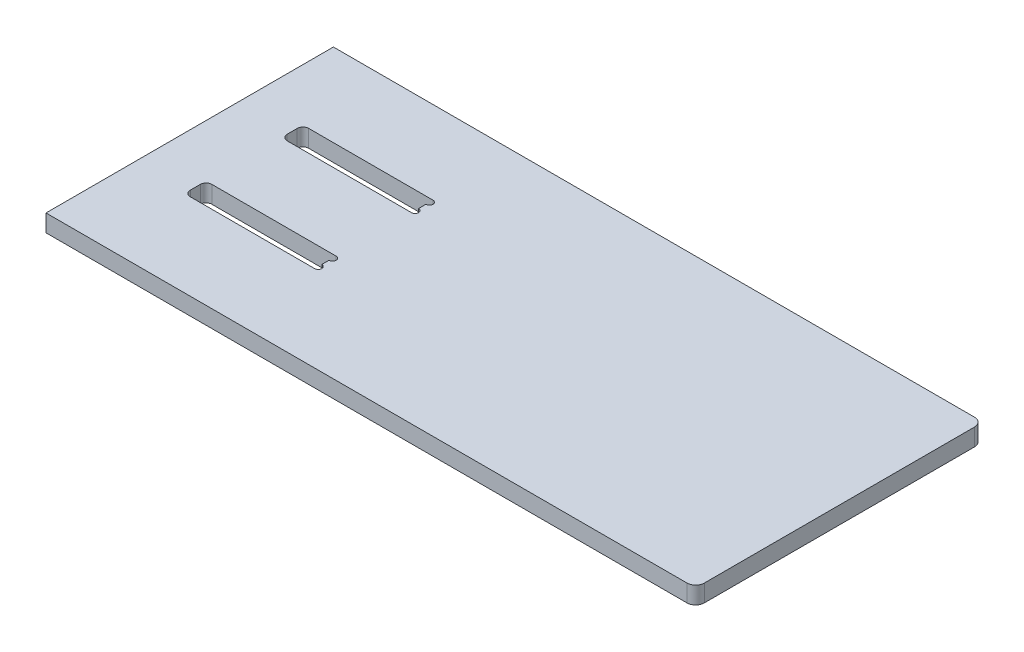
SolidWorks part; units mm, degrees
ref_plane "Front Plane" through (0, 0, 0) normal (0, 0, 1) x (1, 0, 0)
ref_plane "Top Plane" through (0, 0, 0) normal (0, 1, 0) x (1, 0, 0)
ref_plane "Right Plane" through (0, 0, 0) normal (1, 0, 0) x (0, 0, -1)
sketch "Sketch2" plane through (0, 0, 0) normal (0, 1, 0) x (1, 0, 0)
  line L0 (-99.07, -35.0733) -> (-99.07, -30.0733)
  line L1 (220.05, 100) -> (-226.05, 100)
  line L2 (226.05, 94) -> (226.05, -94)
  line L3 (220.05, -100) -> (-226.05, -100)
  line L4 (-226.05, 100) -> (-226.05, -100)
  line L5 (226.05, 100) -> (-226.05, -100) construction
  line L6 (226.05, -100) -> (-226.05, 100) construction
  line L7 (-185.57, -25.0733) -> (-99.07, -25.0733)
  line L8 (-189.57, -29.0733) -> (-189.57, -36.0733)
  line L9 (-185.57, -40.0733) -> (-99.07, -40.0733)
  line L10 (-96.57, -25.0733) -> (-96.57, -40.0733) construction
  line L11 (-189.57, -25.0733) -> (-96.57, -40.0733) construction
  line L12 (-189.57, -40.0733) -> (-96.57, -25.0733) construction
  line L13 (-99.07, -25.0733) -> (-96.57, -25.0733) construction
  line L14 (-99.07, -40.0733) -> (-96.57, -40.0733) construction
  line L15 (-185.57, 27.3567) -> (-99.07, 27.3567)
  line L16 (-99.07, 32.3567) -> (-99.07, 37.3567)
  line L17 (-185.57, 42.3567) -> (-99.07, 42.3567)
  line L18 (-189.57, 38.3567) -> (-189.57, 31.3567)
  line L19 (-189.57, 27.3567) -> (-96.57, 42.3567) construction
  line L20 (-189.57, 42.3567) -> (-96.57, 27.3567) construction
  line L21 (-96.57, 42.3567) -> (-96.57, 27.3567) construction
  arc A0 (226.05, -94) -> (220.05, -100) centre (220.05, -94) cw
  arc A1 (220.05, 100) -> (226.05, 94) centre (220.05, 94) cw
  arc A2 (-189.57, -36.0733) -> (-185.57, -40.0733) centre (-185.57, -36.0733) ccw
  arc A3 (-185.57, -25.0733) -> (-189.57, -29.0733) centre (-185.57, -29.0733) ccw
  arc A4 (-99.07, -30.0733) -> (-99.07, -25.0733) centre (-99.07, -27.5733) ccw
  arc A5 (-99.07, -40.0733) -> (-99.07, -35.0733) centre (-99.07, -37.5733) ccw
  arc A6 (-99.07, 27.3567) -> (-99.07, 32.3567) centre (-99.07, 29.8567) ccw
  arc A7 (-99.07, 37.3567) -> (-99.07, 42.3567) centre (-99.07, 39.8567) ccw
  arc A8 (-185.57, 42.3567) -> (-189.57, 38.3567) centre (-185.57, 38.3567) ccw
  arc A9 (-189.57, 31.3567) -> (-185.57, 27.3567) centre (-185.57, 31.3567) ccw
  point P0 (0, 0)
  point P12 (-143.07, -32.5733)
  dimension "D3" = 6
  dimension "D5" = 4
  dimension "D9" = 2.5
  dimension "D1" = 200
  dimension "D2" = 452.1
  dimension "D4" = 67.4267
  dimension "D6" = 15
  dimension "D7" = 82.98
  dimension "D8" = 93
  dimension "D10" = 2
extrude "Boss-Extrude1" add sketch "Sketch2" along normal blind 12
